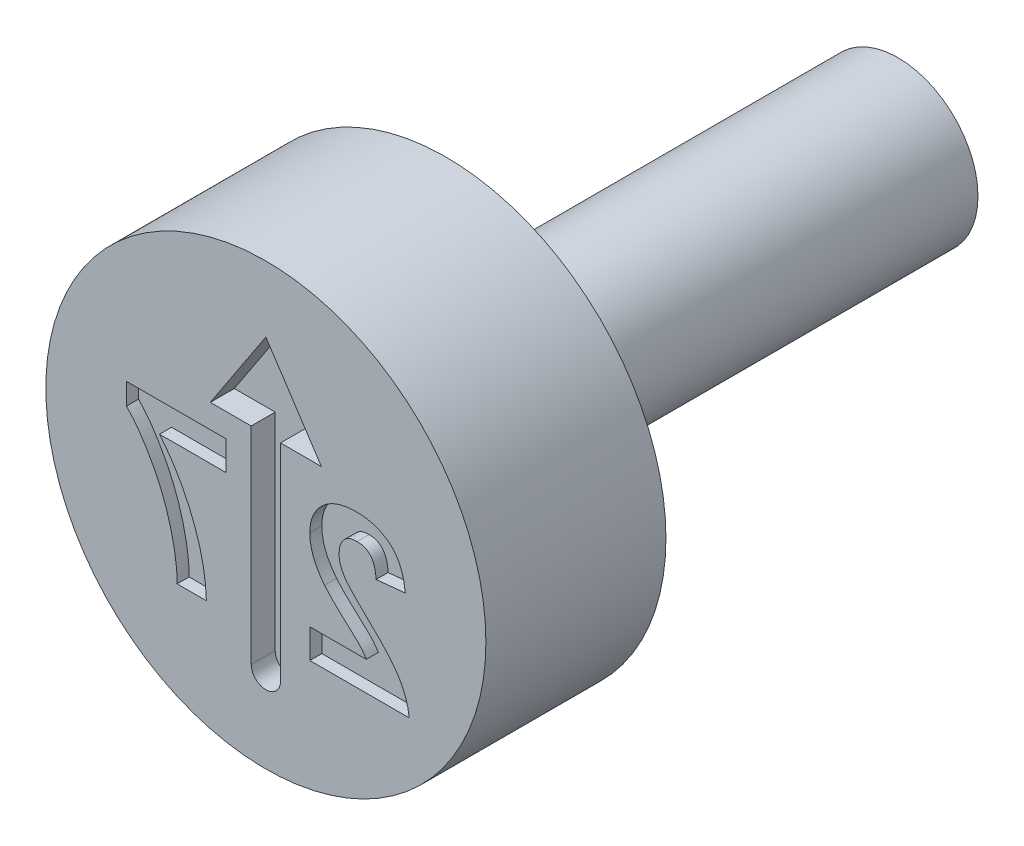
SolidWorks part; units mm, degrees
ref_plane "Front Plane" through (0, 0, 0) normal (0, 0, 1) x (1, 0, 0)
ref_plane "Top Plane" through (0, 0, 0) normal (0, 1, 0) x (1, 0, 0)
ref_plane "Right Plane" through (0, 0, 0) normal (1, 0, 0) x (0, 0, -1)
sketch "Sketch2" plane through (0, 0, 0) normal (1, 0, 0) x (0, 0, -1)
  line L0 (0.4039, 0) -> (50000.4039, 0) construction
  line L6 (0, 5.5) -> (0, 0)
  line L7 (4.5, 5.5) -> (0, 5.5)
  line L8 (4.5, 2) -> (4.5, 5.5)
  line L9 (15.8, 2) -> (4.5, 2)
  line L10 (15.8, 0) -> (15.8, 2)
  line L11 (0, 0) -> (15.8, 0)
  dimension "D1" = 11
  dimension "D2" = 4
  dimension "D3" = 15.8
  dimension "D4" = 4.5
revolve "Revolve1" add sketch "Sketch2" angle 360 about L0
sketch "Sketch3" plane through (0, 0, 0) normal (0, 0, 1) x (1, 0, 0)
  line L0 (0, 0) -> (0, 192375) construction
  line L1 (0.3664, 1.7436) -> (0.3664, -3.4169)
  line L2 (1.3888, 1.7436) -> (0.3664, 1.7436)
  line L3 (0, 3.8516) -> (1.3888, 1.7436)
  line L15 (0, 3.8516) -> (-1.3888, 1.7436)
  line L16 (-1.3888, 1.7436) -> (-0.3664, 1.7436)
  line L17 (-0.3664, 1.7436) -> (-0.3664, -3.4169)
  arc A2 (-0.3664, -3.4169) -> (0.3664, -3.4169) centre (0, -3.4169) ccw
extrude "Cut-Extrude4" cut sketch "Sketch3" against normal blind 0.6
sketch "Sketch4" plane through (0, 0, 0) normal (0, 0, 1) x (1, 0, 0)
  text T0 "2  7" font "Arial" height 3.8
  dimension "D1" = 2.6
extrude "Cut-Extrude5" cut sketch "Sketch4" against normal blind 0.3
